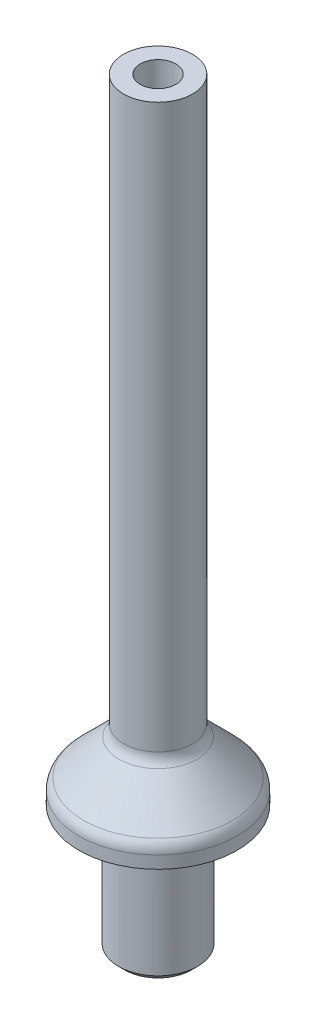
SolidWorks part; units mm, degrees
ref_plane "Front" through (0, 0, 0) normal (0, 0, 1) x (1, 0, 0)
ref_plane "Top" through (0, 0, 0) normal (0, 1, 0) x (1, 0, 0)
ref_plane "Right" through (0, 0, 0) normal (1, 0, 0) x (0, 0, -1)
sketch "Sketch1" plane through (0, 0, 0) normal (0, 0, 1) x (1, 0, 0)
  line L0 (-7.9375, -25.4) -> (-7.9375, -1.905)
  line L1 (-3.5719, 127) -> (-3.5719, -7.62)
  line L2 (-6.9215, 127) -> (-3.5719, 127)
  line L3 (-7.0485, 127) -> (-7.0485, 121.92) construction
  line L4 (-3.5719, -7.62) -> (-4.8895, -7.62)
  line L5 (-4.8895, -7.62) -> (-4.8895, -25.4)
  line L6 (-6.9215, 0) -> (-15.875, 0)
  line L7 (-7.9375, -25.4) -> (-4.8895, -25.4)
  line L8 (0, 0) -> (0, 132.3344) construction
  line L9 (-6.9215, 12.7635) -> (-15.875, 3.81)
  line L10 (-15.875, 3.81) -> (-15.875, 0)
  line L11 (-7.9375, -1.905) -> (-6.9215, -1.905)
  line L12 (-6.9215, -1.905) -> (-6.9215, 0)
  line L13 (-6.9215, 127) -> (-6.9215, 12.7635)
  dimension "D6" = 135
  dimension "D2" = 25.4
  dimension "D3" = 15.875
  dimension "D4" = 0.127
  dimension "D5" = 3.048
  dimension "D7" = 3.81
  dimension "D8" = 17.78
  dimension "D9" = 1.016
  dimension "D10" = 31.75
  dimension "D11" = 1.905
  dimension "D13" = 127
  dimension "D14" = 7.1437
revolve "Revolve1" add sketch "Sketch1" angle 360 about L8
sketch "Sketch11" plane through (-8.4074, 0, -14.3614) normal (0, -1, 0) x (1, 0, 0)
  line L0 (8.4074, 30.2364) -> (8.4074, 14.3614) construction
  circle A0 centre (8.4074, 14.3614) radius 15.875 construction
ref_plane "Plane3" through (0, 0, 0) normal (0, 0, -1) x (1, 0, 0)
sketch "Groove Sketch" plane through (0, 0, 0) normal (0, 0, 1) x (0, -1, 0)
  line L0 (-2.1971, -8.5217) -> (0, -8.5217)
  line L1 (0, -8.5217) -> (0, -13.1445)
  line L2 (0, -13.1445) -> (-2.1971, -13.1445)
  line L3 (-2.6416, -12.7) -> (-2.6416, -8.9662)
  line L4 (0, 0) -> (-1.5769, 0) construction
  line L6 (0, -15.875) -> (0, 15.875) construction
  arc A0 (-2.1971, -13.1445) -> (-2.6416, -12.7) centre (-2.1971, -12.7) cw
  arc A1 (-2.6416, -8.9662) -> (-2.1971, -8.5217) centre (-2.1971, -8.9662) cw
  dimension "D1" = 4.6228
  dimension "Radius" = 0.4445
  dimension "ID" = 17.0434
  dimension "Depth" = 2.6416
revolve "O-Ring Groove" cut sketch "Groove Sketch" angle 360 about L4
other "face static - liquid (as 568)<1>"
fillet "Fillet2" radius 0.127 2 edges at (-8.5217, 0, 0) (-13.1445, 0, 0)
fillet "Fillet3" radius 3.175 2 edges at (0, 3.81, -15.875) (0, 12.7635, -6.9215)
chamfer "Chamfer1" distance 1.27 angle 45 1 edges at (0, -25.4, -7.9375)
ref_plane "Plane4" through (0, 0, 0) normal (-1, 0, 0) x (0, 0, -1)
